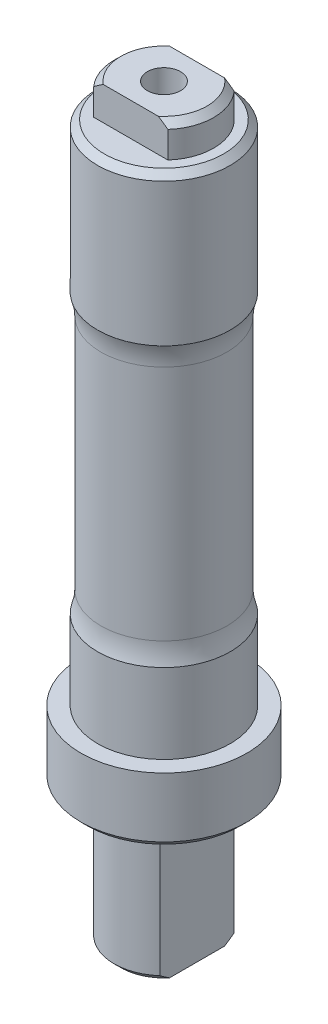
SolidWorks part; units mm, degrees
ref_plane "Plan de face" through (0, 0, 0) normal (0, 0, 1) x (1, 0, 0)
ref_plane "Plan de dessus" through (0, 0, 0) normal (0, 1, 0) x (1, 0, 0)
ref_plane "Plan de droite" through (0, 0, 0) normal (1, 0, 0) x (0, 0, -1)
sketch "Esquisse1" plane through (0, 0, 0) normal (1, 0, 0) x (0, 0, -1)
  line L0 (0, 38.9819) -> (0, -66.3143) construction
  line L1 (0, 30.9856) -> (7.5, 30.9856)
  line L2 (7.5, 30.9856) -> (7.5, 25.9856)
  line L3 (7.5, 25.9856) -> (10, 25.9856)
  line L4 (10, 25.9856) -> (10, 3.4856)
  line L5 (10, -50.5144) -> (12.5, -50.5144)
  line L6 (12.5, -50.5144) -> (12.5, -60.5144)
  line L7 (12.5, -60.5144) -> (7.5, -60.5144)
  line L8 (7.5, -60.5144) -> (7.5, -81.5144)
  line L9 (7.5, -81.5144) -> (0, -81.5144)
  line L10 (0, 30.9856) -> (0, -81.5144)
  line L11 (10, -50.5144) -> (10, -38.5144)
  line L12 (10, 3.4856) -> (9.5, 3.4856)
  line L13 (9.5, 3.4856) -> (9.5, -38.5144)
  line L14 (9.5, -38.5144) -> (10, -38.5144)
  dimension "D1" = 7.5
  dimension "D2" = 5
  dimension "D3" = 2.5
  dimension "D4" = 76.5
  dimension "D5" = 10
  dimension "D6" = 5
  dimension "D7" = 7.5
  dimension "D8" = 21
  dimension "D9" = 5
  dimension "D11" = 2.5
  dimension "D12" = 25
  dimension "D13" = 0.5
  dimension "D16" = 12
  dimension "D17" = 22.5
revolve "Révolution1" add sketch "Esquisse1" angle 360 about L0
sketch "Esquisse2" plane through (0, 30.9856, 0) normal (0, 1, 0) x (-1, 0, 0)
  line L1 (7.8929, -5) -> (-7.8929, -5)
  line L2 (7.8929, -5) -> (7.8929, 5)
  line L3 (7.8929, 5) -> (-7.8929, 5)
  line L4 (-7.8929, -5) -> (-7.8929, 5)
  line L5 (7.8929, -5) -> (-7.8929, 5) construction
  line L6 (7.8929, 5) -> (-7.8929, -5) construction
  point P0 (0, 0)
  dimension "D1" = 10
extrude "Extrusion1" cut sketch "Esquisse2" against normal blind 5 flip side to cut
sketch "Esquisse3" plane through (0, -81.5144, 0) normal (0, -1, 0) x (1, 0, 0)
  line L1 (5, -7.8446) -> (-5, -7.8446)
  line L2 (5, -7.8446) -> (5, 7.8446)
  line L3 (5, 7.8446) -> (-5, 7.8446)
  line L4 (-5, -7.8446) -> (-5, 7.8446)
  line L5 (5, -7.8446) -> (-5, 7.8446) construction
  line L6 (5, 7.8446) -> (-5, -7.8446) construction
  point P0 (0, 0)
  dimension "D1" = 10
extrude "Extrusion2" cut sketch "Esquisse3" against normal blind 21 flip side to cut
chamfer "Chanfrein1" distance 1 angle 45 1 edges at (0, 25.9856, 10)
chamfer "Chanfrein2" distance 1 angle 45 9 edges at (5, -81.5144, 0) (0, -81.5144, -7.5) (0, -81.5144, 7.5) (-5, -81.5144, 0) (0, -60.5144, 12.5) (0, 30.9856, -5) (7.5, 30.9856, 0) (-7.5, 30.9856, 0) (0, 30.9856, 5)
fillet "Congé1" radius 10 1 edges at (0, 3.4856, 9.5)
fillet "Congé2" radius 10 1 edges at (0, -38.5144, 9.5)
hole_wizard "Trou pour taraudage pour trou taraudé M61" positions "Esquisse3D1" profile "Esquisse7" hole size "M6" standard "ISO"
sketch3d "Esquisse3D1"
  point P0 (0, 0, 0)
  point P3 (0, 30.9856, 0)
  point P6 (0, -81.5144, 0)
sketch "Esquisse7" plane through (0, 30.9856, 0) normal (1, 0, 0) x (0, 0, 1)
  line L0 (0, 0) -> (0, 21.5022)
  line L1 (0, 21.5022) -> (2.5, 20)
  line L2 (2.5, 20) -> (2.5, 0)
  line L5 (2.5, 0) -> (0, 0)
  line L10 (0, 21.5022) -> (-2.5, 20) construction
  line L11 (0, -6.35) -> (0, 107.95) construction
  dimension "Diamètre du perçage" = 5
  dimension "Profondeur du perçage" = 20
  dimension "Angle de pointe" = 118
